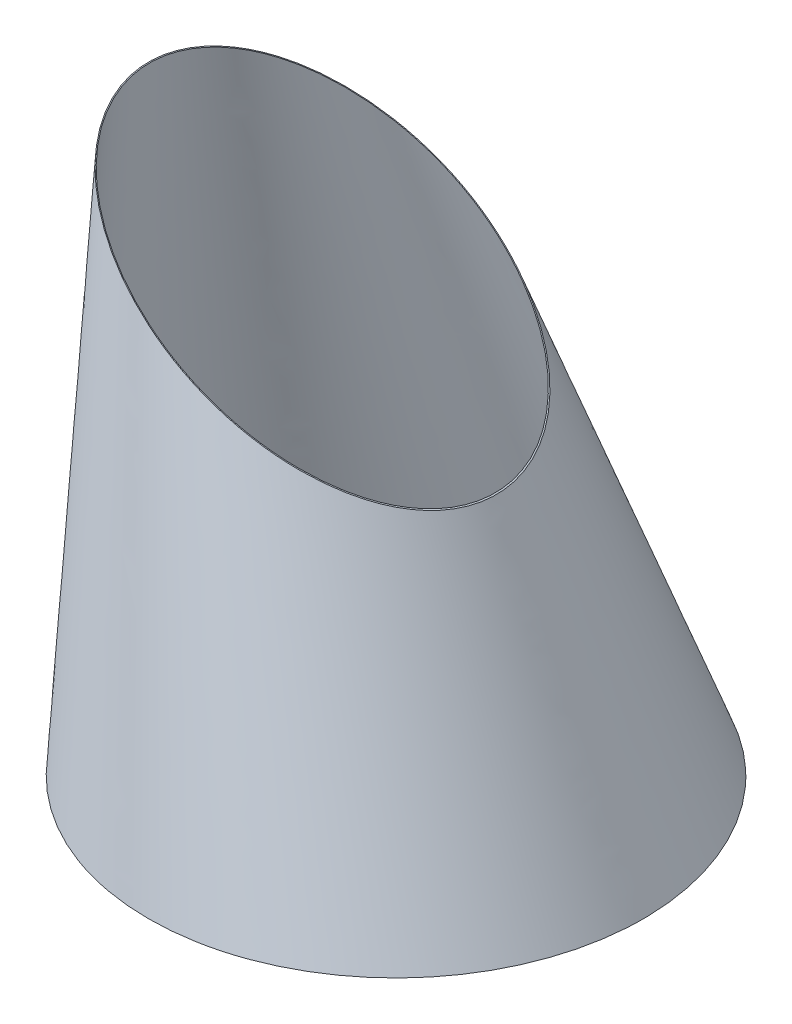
SolidWorks part; units mm, degrees
ref_plane "前视基准面" through (0, 0, 0) normal (0, 0, 1) x (1, 0, 0)
ref_plane "上视基准面" through (0, 0, 0) normal (0, 1, 0) x (1, 0, 0)
ref_plane "右视基准面" through (0, 0, 0) normal (1, 0, 0) x (0, 0, -1)
sketch "草图1" plane through (0, 0, 0) normal (0, 1, 0) x (1, 0, 0)
  line L0 (0, 0) -> (-300, 0) construction
  circle A0 centre (0, 0) radius 300
  dimension "D" = 600
sketch "草图2" plane through (0, 0, 0) normal (0, 0, 1) x (1, 0, 0)
  point P0 (-300, 1200)
  dimension "H" = 1200
loft "放样1" add profiles "草图1", "草图2"
sketch "草图3" plane through (0, 0, 0) normal (0, 0, 1) x (1, 0, 0)
  line L0 (-300, 600) -> (739.2305, 0)
  line L1 (0, 0) -> (739.2305, 0) construction
  dimension "H0" = 600
  dimension "φ" = 30
extrude "切除-拉伸1" cut sketch "草图3" against normal through all and the other way through all
shell "抽壳1"
